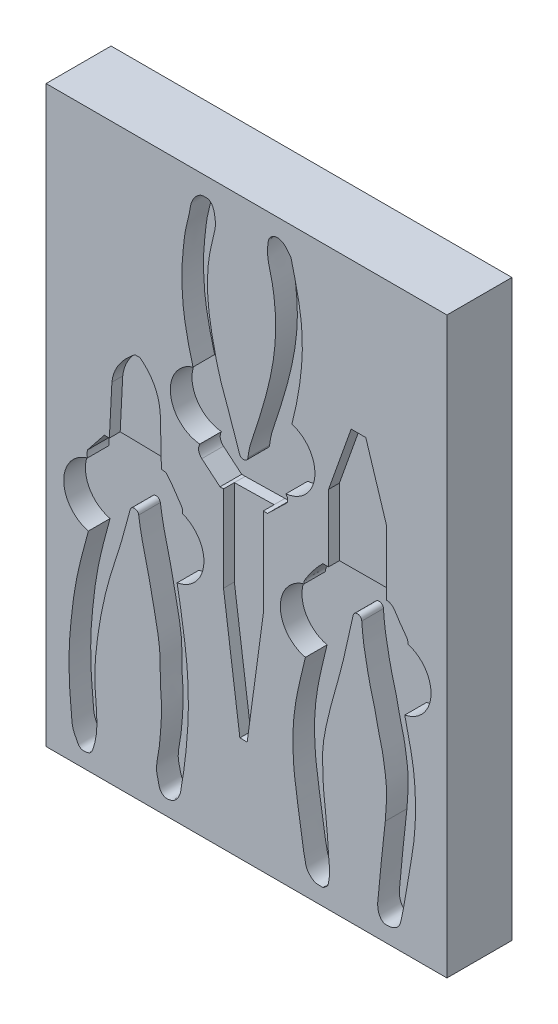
SolidWorks part; units mm, degrees
ref_plane "Front" through (0, 0, 0) normal (0, 0, 1) x (1, 0, 0)
ref_plane "Top" through (0, 0, 0) normal (0, 1, 0) x (1, 0, 0)
ref_plane "Right" through (0, 0, 0) normal (1, 0, 0) x (0, 0, -1)
sketch "Esquisse1" plane through (0, 0, 0) normal (0, 0, 1) x (1, 0, 0)
  line L1 (92.5, -132.5) -> (-92.5, -132.5)
  line L2 (92.5, -132.5) -> (92.5, 132.5)
  line L3 (92.5, 132.5) -> (-92.5, 132.5)
  line L4 (-92.5, -132.5) -> (-92.5, 132.5)
  line L5 (92.5, -132.5) -> (-92.5, 132.5) construction
  line L6 (92.5, 132.5) -> (-92.5, -132.5) construction
  point P1 (0, 0)
  dimension "D1" = 185
  dimension "D2" = 265
extrude "Boss.-Extru.1" add sketch "Esquisse1" along normal blind 30
other "Empreinte1"
other "pince-coupante-2<1>@Assemblage-insert-knipex1"
other "pince-bec<1>@Assemblage-insert-knipex1"
other "grosse-pince<1>@Assemblage-insert-knipex1"
